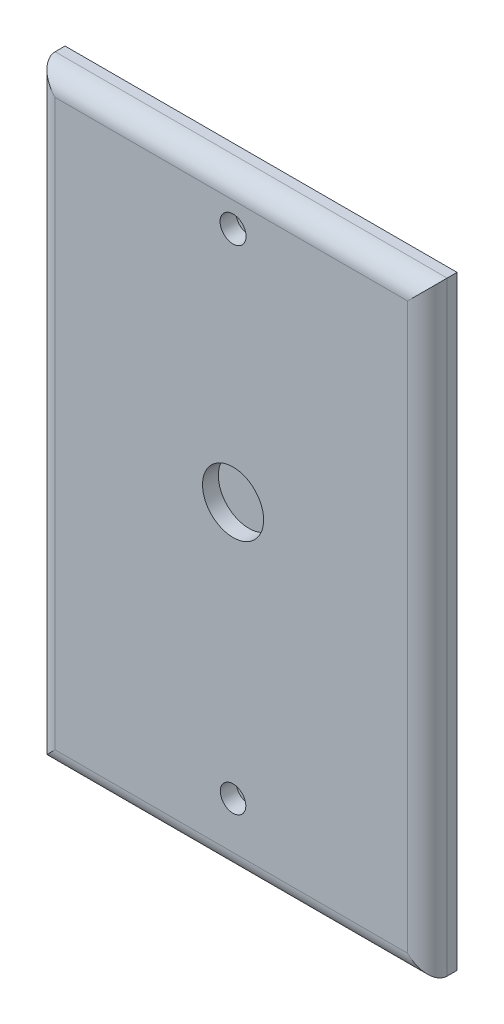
SolidWorks part; units mm, degrees
ref_plane "Front Plane" through (0, 0, 0) normal (0, 0, 1) x (1, 0, 0)
ref_plane "Top Plane" through (0, 0, 0) normal (0, 1, 0) x (1, 0, 0)
ref_plane "Right Plane" through (0, 0, 0) normal (1, 0, 0) x (0, 0, -1)
sketch "Sketch1" plane through (0, 0, 0) normal (0, 0, 1) x (1, 0, 0)
  line L0 (-114.429, -165.8718) -> (86.8035, 144.4404) construction
  line L1 (-114.429, 144.4404) -> (86.8035, 144.4404)
  line L2 (-114.429, 144.4404) -> (-114.429, -165.8718)
  line L3 (-114.429, -165.8718) -> (86.8035, -165.8718)
  line L4 (86.8035, 144.4404) -> (86.8035, -165.8718)
  point P4 (0, 0)
  point P5 (-5.1127, -100.8015)
  point P7 (52.1004, -6.1601)
  dimension "D1" = 52.1004
  dimension "D2" = 86.8035
  dimension "D3" = 5.1127
  dimension "D4" = 114.429
  dimension "D5" = 144.4404
  dimension "D6" = 6.1601
  dimension "D7" = 100.8015
  dimension "D8" = 165.8718
extrude "Extrude1" add sketch "Sketch1" along normal blind 15.24
sketch "Sketch2" plane through (0, 0, 15.24) normal (0, 0, 1) x (1, 0, 0)
  line L0 (-114.429, 144.4404) -> (-114.429, -165.8718) construction
  line L1 (-114.429, -165.8718) -> (86.8035, -165.8718) construction
  circle A0 centre (-12.9354, 121.4837) radius 6.6727
  circle A1 centre (-12.9354, -131.7106) radius 6.5488
  circle A2 centre (-12.9354, 0) radius 15.6784
  dimension "D1" = 13.3454
  dimension "D2" = 31.3567
  dimension "D3" = 13.0977
  dimension "D4" = 101.4936
  dimension "D5" = 34.1611
  dimension "D6" = 165.8718
  dimension "D7" = 287.3555
extrude "Cut-Extrude1" cut sketch "Sketch2" against normal blind 8.128
fillet "Fillet1" radius 10.16 4 edges at (-114.429, -10.7157, 15.24) (-13.8128, -165.8718, 15.24) (86.8035, -10.7157, 15.24) (-13.8128, 144.4404, 15.24)
